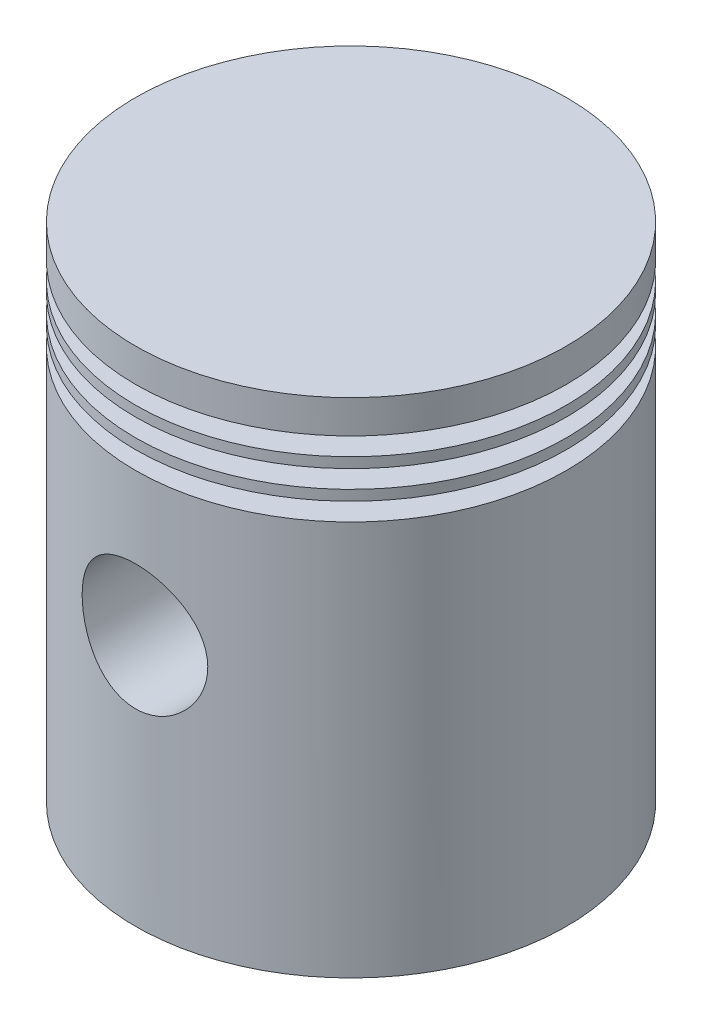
SolidWorks part; units mm, degrees
ref_plane "Front" through (0, 0, 0) normal (0, 0, 1) x (1, 0, 0)
ref_plane "Top" through (0, 0, 0) normal (0, 1, 0) x (1, 0, 0)
ref_plane "Right" through (0, 0, 0) normal (1, 0, 0) x (0, 0, -1)
sketch "Sketch1" plane through (0, 0, 0) normal (1, 0, 0) x (0, 0, -1)
  line L0 (38.1, 88.9) -> (0, 88.9)
  line L1 (0, 88.9) -> (0, 84.1375)
  line L2 (0, 84.1375) -> (28.575, 84.1375)
  line L3 (28.575, 84.1375) -> (28.575, 44.45)
  line L4 (28.575, 44.45) -> (34.925, 44.45)
  line L5 (34.925, 44.45) -> (34.925, 4.7625)
  line L6 (34.925, 4.7625) -> (33.3375, 4.7625)
  line L7 (33.3375, 4.7625) -> (33.3375, 0)
  line L8 (33.3375, 0) -> (38.1, 0)
  line L9 (38.1, 0) -> (38.1, 88.9)
  line L10 (0, 88.9) -> (0, 0) construction
  dimension "D1" = 28.575
  dimension "D2" = 33.3375
  dimension "D3" = 34.925
  dimension "D4" = 38.1
  dimension "D5" = 4.7625
  dimension "D6" = 44.45
  dimension "D7" = 84.1375
  dimension "D8" = 88.9
revolve "Piston" add sketch "Sketch1" angle 180 about L10
ref_plane "Plano medio" through (0, 0, 13.208) normal (0, 0, 1) x (1, 0, 0)
sketch "Sketch5" plane through (0, 0, 13.208) normal (0, 0, 1) x (1, 0, 0)
  line L0 (0, -55.9859) -> (0, 55.9859) construction
  line L1 (-38.1, 0) -> (0, 0) construction
  line L2 (0, 0) -> (0, 88.9) construction
  line L3 (0, 30.1625) -> (0, 58.7375)
  arc A0 (0, 58.7375) -> (0, 30.1625) centre (0, 44.45) ccw
  dimension "D2" = 28.575
  dimension "D1" = 44.45
extrude "Saliente circular" add sketch "Sketch5" along normal up to next
sketch "Sketch6" plane through (0, 0, 13.208) normal (0, 0, 1) x (1, 0, 0)
  circle A0 centre (0, 44.45) radius 11.1125
  dimension "D1" = 22.225
extrude "Corte circular lateral" cut sketch "Sketch6" along normal through all
sketch "Sketch7" plane through (0, 7.4473, 55.2427) normal (1, 0, 0) x (0, 0, -1)
  line L0 (93.3427, 62.4027) -> (93.3427, 65.5777)
  line L1 (93.3427, 65.5777) -> (88.5802, 65.5777)
  line L2 (88.5802, 65.5777) -> (88.5802, 62.4027)
  line L3 (88.5802, 62.4027) -> (93.3427, 62.4027)
  line L4 (55.2427, 65.5777) -> (55.2427, 62.4027) construction
  line L7 (93.3427, -7.4473) -> (93.3427, 81.4527) construction
  dimension "D1" = 33.3375
  dimension "D2" = 38.1
  dimension "D3" = 3.175
  dimension "D4" = 69.85
revolve "Ranura" cut sketch "Sketch7" angle 360 about L4
pattern_linear "LPattern1" count 3 spacing 5 along (0, 1, 0) of "Ranura"
mirror "Mirror2" about plane through (0, 0, 0) normal (0, 0, 1) of "Saliente circular", "Corte circular lateral"
mirror "Mirror3" about plane through (0, 0, 0) normal (1, 0, 0) of "Ranura", "LPattern1", "Piston", "Mirror2", "Saliente circular", "Corte circular lateral"
